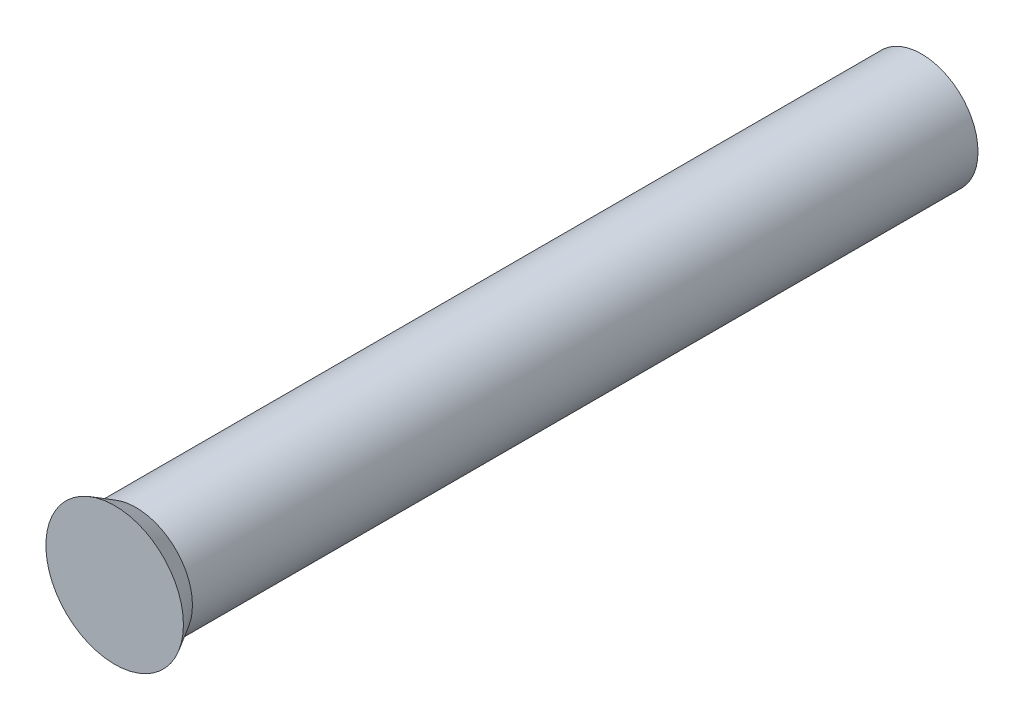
SolidWorks part; units mm, degrees
ref_plane "Front Plane" through (0, 0, 0) normal (0, 0, 1) x (1, 0, 0)
ref_plane "Top Plane" through (0, 0, 0) normal (0, 1, 0) x (1, 0, 0)
ref_plane "Right Plane" through (0, 0, 0) normal (1, 0, 0) x (0, 0, -1)
sketch "Sketch2" plane through (0, 0, 0) normal (0, 0, 1) x (1, 0, 0)
  circle A0 centre (0, 0) radius 1.397
  dimension "D1" = 2.794
extrude "Boss-Extrude1" add sketch "Sketch2" along normal blind 19.812 contours A0
sketch "Sketch3" plane through (0, 0, 0) normal (1, 0, 0) x (0, 0, -1)
  line L1 (0, 1.397) -> (-19.812, 1.397) construction
  line L2 (0, -1.397) -> (0, 1.397) construction
  line L3 (-2.794, 0) -> (0, 0) construction
  line L4 (-0.3743, 1.397) -> (0.8008, 1.397)
  line L5 (0.8008, 1.397) -> (0.8008, 0)
  line L6 (0, 0) -> (0.8008, 0)
  arc A0 (0, 0) -> (-0.3743, 1.397) centre (-2.794, 0) ccw
  dimension "D1" = 2.794
revolve "Cut-Revolve3" cut sketch "Sketch3" angle 360 about L3
sketch "Sketch4" plane through (0, 0, 0) normal (1, 0, 0) x (0, 0, -1)
  line L0 (-19.812, 1.397) -> (-20.3399, 1.7018)
  line L1 (-200002.794, 0) -> (200000, 0) construction
  line L2 (-20.3399, 1.7018) -> (-20.3399, 0)
  line L3 (-20.3399, 0) -> (-19.812, 0)
  line L4 (-19.812, 0) -> (-19.812, 1.397)
  dimension "D1" = 30
  dimension "D2" = 1.7018
revolve "Revolve1" add sketch "Sketch4" angle 360 about L3
